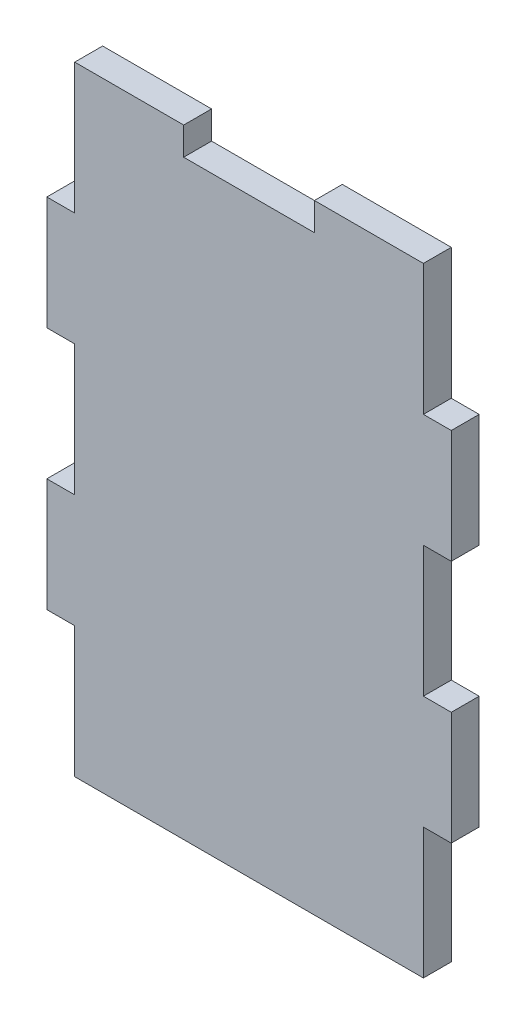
SolidWorks part; units mm, degrees
ref_plane "Front Plane" through (0, 0, 0) normal (0, 0, 1) x (1, 0, 0)
ref_plane "Top Plane" through (0, 0, 0) normal (0, 1, 0) x (1, 0, 0)
ref_plane "Right Plane" through (0, 0, 0) normal (1, 0, 0) x (0, 0, -1)
sketch "Sketch1" plane through (0, 0, 0) normal (0, 0, 1) x (1, 0, 0)
  line L0 (0, 355) -> (232, 355)
  line L1 (0, 0) -> (232, 0)
  line L2 (0, 0) -> (0, 355)
  line L4 (216, 215) -> (216, 140)
  line L5 (232, 140) -> (216, 140)
  line L6 (0, 0) -> (16, 0)
  line L7 (0, 0) -> (0, 75)
  line L8 (0, 355) -> (16, 355)
  line L9 (0, 355) -> (0, 280)
  line L10 (0, 280) -> (16, 280)
  line L11 (16, 355) -> (16, 280)
  line L12 (0, 75) -> (16, 75)
  line L13 (16, 0) -> (16, 75)
  line L14 (0, 215) -> (16, 215)
  line L15 (0, 215) -> (0, 140)
  line L16 (0, 140) -> (16, 140)
  line L17 (16, 215) -> (16, 140)
  line L18 (232, 215) -> (232, 140)
  line L19 (232, 215) -> (216, 215)
  line L20 (216, 0) -> (216, 75)
  line L21 (232, 75) -> (216, 75)
  line L22 (216, 355) -> (216, 280)
  line L23 (232, 280) -> (216, 280)
  line L24 (232, 355) -> (232, 280)
  line L25 (232, 355) -> (216, 355)
  line L26 (232, 0) -> (232, 75)
  line L27 (232, 0) -> (216, 0)
  line L28 (232, 0) -> (232, 355)
  line L29 (78.5, 355) -> (153.5, 355)
  line L30 (78.5, 355) -> (78.5, 339)
  line L31 (78.5, 339) -> (153.5, 339)
  line L32 (153.5, 355) -> (153.5, 339)
  point P5 (16, 177.5)
  point P6 (0, 177.5)
  point P19 (116, 0)
  point P32 (116, 339)
  point P33 (116, 355)
extrude "Boss-Extrude1" add sketch "Sketch1" along normal blind 16
equation "\"thk\"= 16mm"
equation "\"D4@Sketch1\"=\"thk\""
equation "\"D9@Sketch1\"=\"thk\""
equation "\"D6@Sketch1\"=\"thk\""
equation "\"D13@Sketch1\"=\"thk\""
equation "\"D14@Sketch1\"=\"thk\""
equation "\"D15@Sketch1\"=\"thk\""
equation "\"D16@Sketch1\"=\"thk\""
